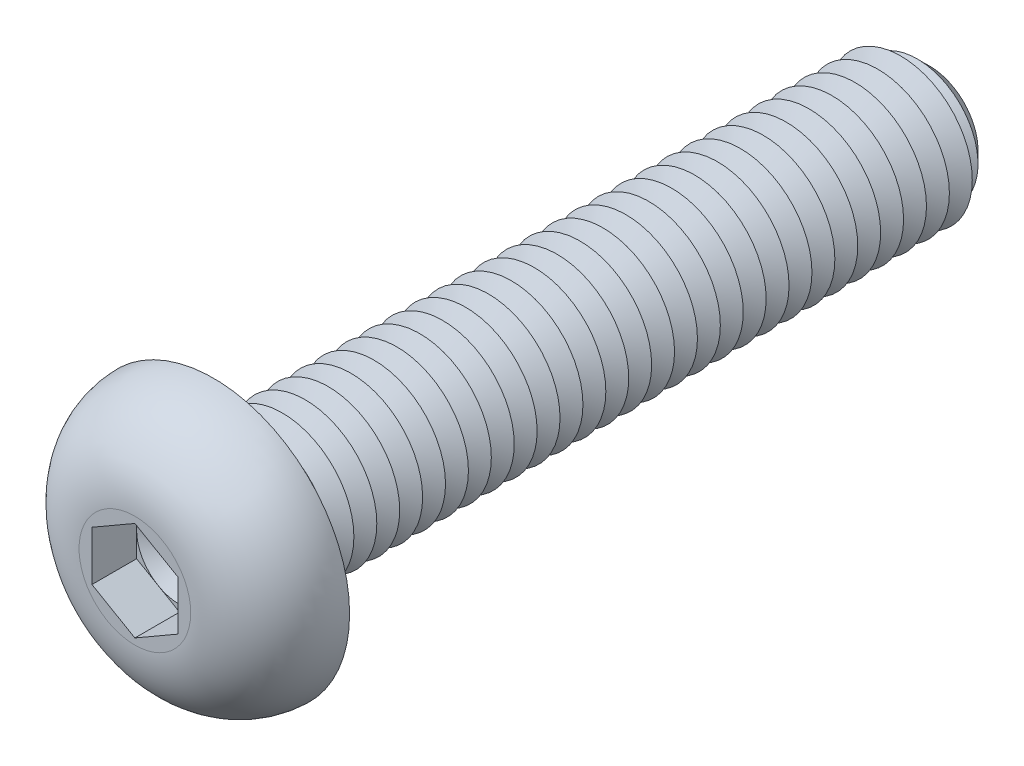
SolidWorks part; units mm, degrees
ref_plane "Front Plane" through (0, 0, 0) normal (0, 0, 1) x (1, 0, 0)
ref_plane "Top Plane" through (0, 0, 0) normal (0, 1, 0) x (1, 0, 0)
ref_plane "Right Plane" through (0, 0, 0) normal (1, 0, 0) x (0, 0, -1)
sketch "Sketch1" plane through (0, 0, 0) normal (1, 0, 0) x (0, 0, -1)
  line L0 (-47.9342, 0) -> (60.3146, 0) construction
sketch "Sketch2" plane through (0, 0, 0) normal (1, 0, 0) x (0, 0, -1)
  line L0 (0, 0) -> (-2.75, 0)
  line L1 (-47.9342, 0) -> (60.3146, 0) construction
  line L2 (-2.75, 0) -> (-2.75, 1.9504)
  line L3 (0, 4.75) -> (0, 0)
  arc A0 (-2.75, 1.9504) -> (0, 4.75) centre (0.05, 1.9504) cw
  dimension "D1" = 2.8
  dimension "D2" = 2.75
  dimension "D3" = 4.75
revolve "Revolve1" add sketch "Sketch2" angle 360 about L0
sketch "Sketch3" plane through (0, 0, 2.75) normal (0, 0, 1) x (1, 0, 0)
  line L1 (0, 1.7321) -> (-1.5, 0.866)
  line L2 (-1.5, 0.866) -> (-1.5, -0.866)
  line L3 (-1.5, -0.866) -> (0, -1.7321)
  line L4 (0, -1.7321) -> (1.5, -0.866)
  line L5 (1.5, -0.866) -> (1.5, 0.866)
  line L6 (1.5, 0.866) -> (0, 1.7321)
  circle A0 centre (0, 0) radius 1.5 construction
  dimension "D1" = 3
extrude "Cut-Extrude1" cut sketch "Sketch3" against normal blind 1.56
sketch "Sketch4" plane through (0, 0, 0) normal (0, 0, -1) x (-1, 0, 0)
  circle A0 centre (0, 0) radius 2.5
  dimension "D1" = 5
extrude "Boss-Extrude1" add sketch "Sketch4" along normal blind 25
chamfer "Chamfer1" distance 0.8 angle 45 1 edges at (-2.5, 0, -25)
sketch "Sketch5" plane through (0, 0, 0) normal (1, 0, 0) x (0, 0, -1)
  line L0 (0.8, 2.5) -> (1.6, 2.5)
  line L1 (24.2, 2.5) -> (0, 2.5) construction
  line L2 (1.6, 2.5) -> (1.2, 1.8072)
  line L3 (1.2, 1.8072) -> (0.8, 2.5)
  line L4 (0, -4.75) -> (0, 4.75) construction
  line L5 (24.2, 2.5) -> (0, 2.5) construction
  dimension "D1" = 0.8
  dimension "D2" = 0.8
revolve "Cut-Revolve1" cut sketch "Sketch5" angle 360 about L0
pattern_linear "LPattern1" count 30 spacing 0.8 along (0, 0, -1) of "Cut-Revolve1"
fillet "Fillet2" radius 0.4 1 edges at (2.5, 0, 0)
sketch "Sketch6" plane through (0, 0, 1.19) normal (0, 0, 1) x (1, 0, 0)
  line L0 (0, -1.7321) -> (1.5, -0.866) construction
  circle A0 centre (0, 0) radius 1.5
extrude "Cut-Extrude2" cut sketch "Sketch6" against normal through all draft 60
